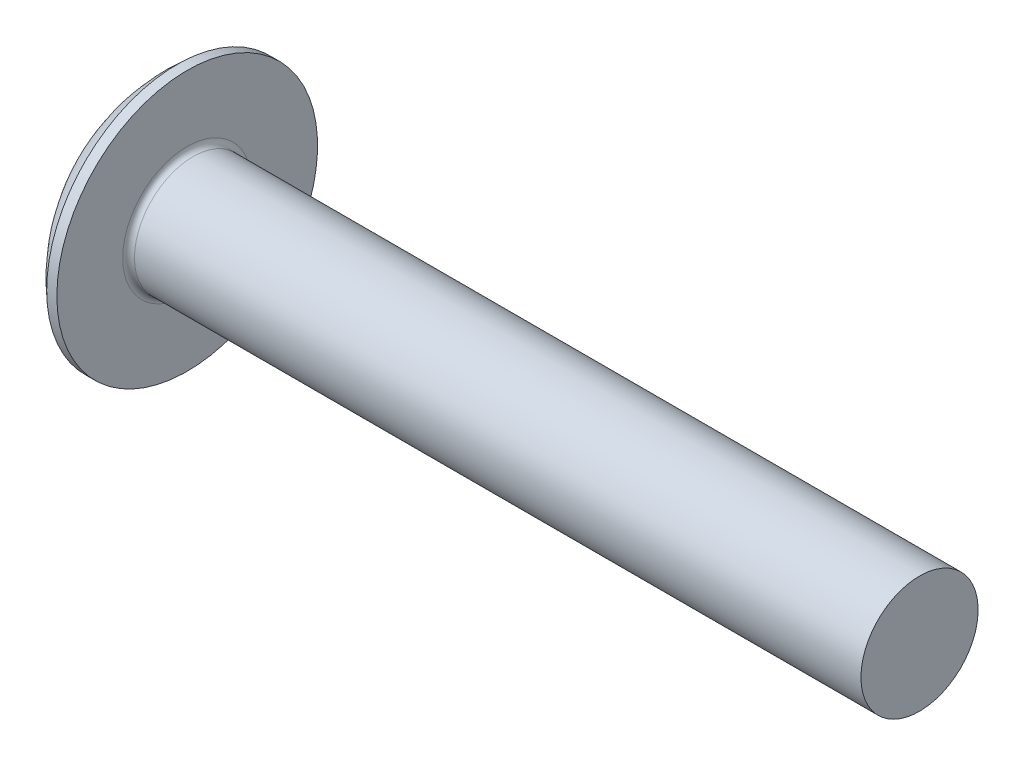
SolidWorks part; units mm, degrees
ref_plane "Front Plane" through (0, 0, 0) normal (0, 0, 1) x (1, 0, 0)
ref_plane "Top Plane" through (0, 0, 0) normal (0, 1, 0) x (1, 0, 0)
ref_plane "Right Plane" through (0, 0, 0) normal (1, 0, 0) x (0, 0, -1)
sketch "BodySke" plane through (0, 0, 0) normal (0, 0, 1) x (1, 0, 0)
  line L0 (0, 0) -> (111.3824, 0) construction
  line L1 (0, 0) -> (0, 8) construction
  line L2 (4.8, 4) -> (4.8, 8.9)
  line L3 (4.8, 8.9) -> (4.1053, 8.9)
  line L4 (4.8, 4) -> (54.8, 4)
  line L5 (54.8, 4) -> (54.8, 0)
  line L6 (6.05, 7.824) -> (6.05, -6.8939) construction
  line L7 (0, 0) -> (54.8, 0)
  line L8 (24.8, 8.824) -> (24.8, -4.958) construction
  arc A0 (0, 0) -> (4.1053, 8.9) centre (11.7, 0) cw
  point P10 (54.8, 3.4455)
  dimension "Head_radius" = 11.7
  dimension "Diameter" = 8
  dimension "Head_dia" = 17.8
  dimension "Head_height" = 4.8
  dimension "Length" = 50
  dimension "Advance" = 1.25
  dimension "Thread_minor" = 6.891
  dimension "Thread_length" = 30
revolve "BaseBody" add sketch "BodySke" angle 360 about L0
fillet "Fillet1" radius 0.4 1 edges at (4.8, 0, 4)
ref_plane "Plane1" through (4.36, 0, 0) normal (1, 0, 0) x (0, 0, -1)
sketch "RecSkeTop" plane through (0, 0, 0) normal (1, 0, 0) x (0, 0, -1)
  line L1 (-0.858, 3.9) -> (0.858, 3.9)
  line L2 (-0.858, 3.9) -> (-0.858, -3.9)
  line L3 (-0.858, -3.9) -> (0.858, -3.9)
  line L4 (0.858, 3.9) -> (0.858, -3.9)
  dimension "D1" = 3.9
  dimension "Cross_dia" = 7.8
  dimension "D2" = 1.716
  dimension "D3" = 0.858
sketch "RecSkeBot" plane through (4.36, 0, 0) normal (1, 0, 0) x (0, 0, -1)
  line L0 (-0.858, 3.9) -> (-0.858, -3.9) construction
  line L1 (-0.858, 1.7262) -> (0.858, 1.7262)
  line L2 (-0.858, 1.7262) -> (-0.858, -1.7262)
  line L3 (-0.858, -1.7262) -> (0.858, -1.7262)
  line L4 (0.858, 1.7262) -> (0.858, -1.7262)
  line L5 (0.858, 3.9) -> (0.858, -3.9) construction
  dimension "D1" = 3.4524
  dimension "D2" = 1.7262
loft "Recess" cut profiles "RecSkeTop", "RecSkeBot"
pattern_circular "RecPat" count 2 every 90 about axis through (0, 0, 0) along (1, 0, 0) of "Recess"
sketch "RecCorSke" plane through (0, 0, 0) normal (0, 0, 1) x (1, 0, 0)
  line L0 (0, 0) -> (57.5987, 0) construction
  line L1 (0, 0) -> (0, 1.8876)
  line L3 (0, 1.8876) -> (4.36, 1.5827)
  line L4 (4.36, 1.5827) -> (4.8743, 0)
  line L5 (4.8743, 0) -> (0, 0)
  dimension "D1" = 18
  dimension "D2" = 4.36
  dimension "D3" = 1.8876
  dimension "D4" = 4
revolve "RecessCore" cut sketch "RecCorSke" angle 360 about L0
sketch "ThdSchSke" plane through (0, 0, 0) normal (0, 0, 1) x (1, 0, 0)
  line L0 (0, 0) -> (55.1256, 0) construction
  line L1 (0, 0) -> (111.3824, 0) construction
  line L2 (54.4799, 4) -> (54.4799, 4.6403)
  line L3 (54.4799, 4.6403) -> (55.1201, 4.6403)
  line L4 (55.1201, 4.6403) -> (55.1201, 4)
  line L5 (55.1201, 4) -> (54.8, 3.4455)
  line L6 (54.8, 3.4455) -> (54.4799, 4)
  line L7 (4.8, 4) -> (54.8, 4) construction
  line L13 (54.8, 4) -> (54.8, 0) construction
revolve "ThreadSchematic" [suppressed] cut sketch "ThdSchSke" angle 360 about L0
pattern_linear "ThdSchPat" [suppressed] count 24 along (1, 0, 0)
equation "\"Thread_minor@ThreadCosmetic\" = \"Thread_minor@BodySke\""
equation "\"D1@RecSkeTop\" = \"Cross_dia@RecSkeTop\" / 2"
equation "\"D2@RecSkeTop\" = \"Cross_dia@RecSkeTop\" * 0.22"
equation "\"D3@RecSkeTop\" = \"D2@RecSkeTop\" / 2"
equation "\"D1@RecSkeBot\" = \"Cross_dia@RecSkeTop\" - 2 * \"Cross_depth@Plane1\" *  tan( 26.5 * 0.017453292 ) "
equation "\"D2@RecSkeBot\" = \"D1@RecSkeBot\" / 2"
equation "\"D2@RecCorSke\" = \"Cross_depth@Plane1\""
equation "\"D3@RecCorSke\" = \"D2@RecSkeTop\" * 1.1"
equation "\"Advance@ThdSchPat\" = \"Advance@BodySke\""
equation "\"D1@ThdSchPat\" =  int( \"Thread_length@BodySke\" / \"Advance@ThdSchPat\" ) "
